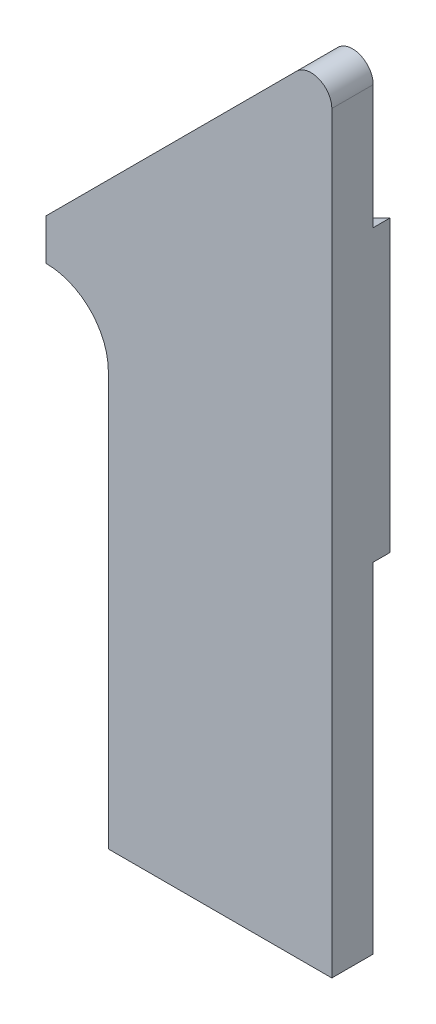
SolidWorks part; units mm, degrees
ref_plane "Front" through (0, 0, 0) normal (0, 0, 1) x (1, 0, 0)
ref_plane "Top" through (0, 0, 0) normal (0, 1, 0) x (1, 0, 0)
ref_plane "Right" through (0, 0, 0) normal (1, 0, 0) x (0, 0, -1)
sketch "Esquisse1" plane through (0, 0, 0) normal (0, 0, 1) x (1, 0, 0)
  line L0 (-27, 25) -> (-42, 25)
  line L1 (27, -90) -> (-27, -90)
  line L2 (27, -90) -> (27, 90)
  line L4 (-27, -90) -> (-27, 25)
  line L5 (27, -90) -> (-27, 90) construction
  line L6 (27, 90) -> (-27, -90) construction
  line L7 (-42, 25) -> (-42, 35)
  line L10 (-42, 35) -> (27, 104)
  line L11 (27, 104) -> (27, 90)
  line L12 (230.5206, 117.4476) -> (961.4084, 91.9245) construction
  point P0 (0, 0)
  dimension "D1" = 180
  dimension "D2" = 54
  dimension "D3" = 115
  dimension "D4" = 10
  dimension "D5" = 15
  dimension "D6" = 45
extrude "Boss.-Extru.1" add sketch "Esquisse1" along normal blind 10
sketch "Esquisse2" plane through (0, 0, 0) normal (0, 0, -1) x (-1, 0, 0)
  line L0 (-27, -90) -> (-27, 104) construction
  line L1 (-27, -8) -> (27, -8)
  line L2 (-27, -8) -> (-27, 27)
  line L4 (27, -8) -> (27, 25)
  line L6 (27, -90) -> (-27, -90) construction
  line L7 (27, 25) -> (42, 25)
  line L8 (42, 25) -> (42, 27)
  line L9 (42, 35) -> (42, 25) construction
  line L10 (42, 27) -> (-27, 62)
  line L11 (-27, 62) -> (-27, 27)
  dimension "D1" = 82
  dimension "D2" = 35
  dimension "D3" = 70
extrude "Boss.-Extru.2" add sketch "Esquisse2" along normal blind 4
fillet "Congé1" radius 15 1 edges at (-27, 25, 3)
fillet "Congé2" radius 5 1 edges at (27, 104, 5)
